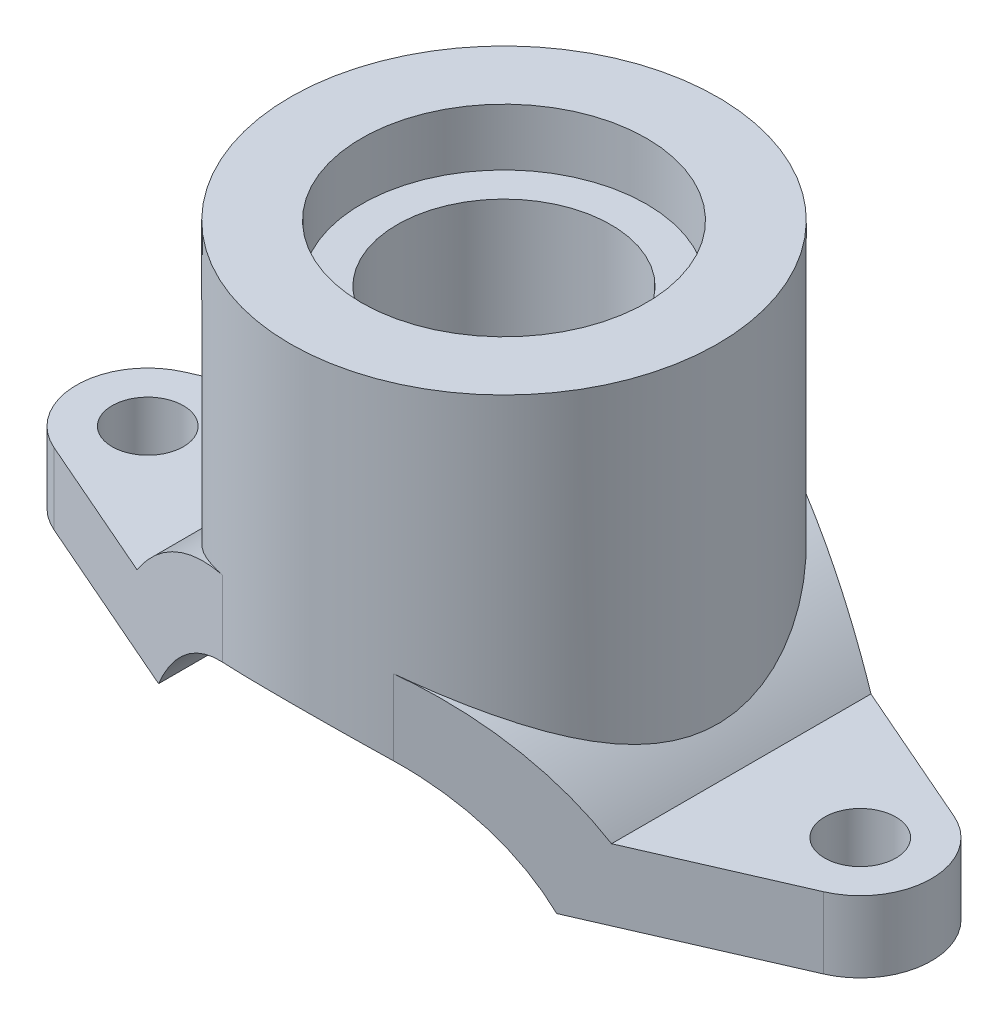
SolidWorks part; units mm, degrees
ref_plane "Front Plane" through (0, 0, 0) normal (0, 0, 1) x (1, 0, 0)
ref_plane "Top Plane" through (0, 0, 0) normal (0, 1, 0) x (1, 0, 0)
ref_plane "Right Plane" through (0, 0, 0) normal (1, 0, 0) x (0, 0, -1)
sketch "Sketch1" plane through (0, 0, 0) normal (0, 0, 1) x (1, 0, 0)
  line L0 (69.8498, 0) -> (150, 0)
  line L1 (-150, 25) -> (-83.2406, 25)
  line L2 (83.2406, 25) -> (150, 25)
  line L3 (-150, 0) -> (-69.8498, 0)
  line L4 (-150, 25) -> (-150, 0)
  line L5 (150, 25) -> (150, 0)
  arc A0 (-69.8498, 0) -> (69.8498, 0) centre (0, -39) cw
  arc A1 (-83.2406, 25) -> (83.2406, 25) centre (0, -39) cw
  dimension "D1" = 80
  dimension "D2" = 39
  dimension "D3" = 300
  dimension "D4" = 25
extrude "Boss-Extrude1" add sketch "Sketch1" along normal mid plane 150
ref_plane "Plane1" through (0, 66, 75) normal (0, 1, 0) x (-1, 0, 0)
sketch "Sketch2" plane through (0, 66, 75) normal (0, 1, 0) x (-1, 0, 0)
  line L0 (-135, -52.0871) -> (-30, -6.2614)
  line L1 (30, -6.2614) -> (135, -52.0871)
  line L2 (-135, -97.9129) -> (-30, -143.7386)
  line L3 (30, -143.7386) -> (135, -97.9129)
  line L4 (83.2406, 0) -> (-83.2406, 0) construction
  arc A0 (-30, -143.7386) -> (30, -143.7386) centre (0, -75) ccw
  arc A1 (135, -97.9129) -> (135, -52.0871) centre (125, -75) ccw
  arc A2 (-135, -52.0871) -> (-135, -97.9129) centre (-125, -75) ccw
  arc A3 (30, -6.2614) -> (-30, -6.2614) centre (0, -75) ccw
  dimension "D2" = 25
  dimension "D3" = 75
  dimension "D1" = 250
extrude "Cut-Extrude1" cut sketch "Sketch2" against normal through all flip side to cut
ref_plane "Plane2" through (0, 150, 0) normal (0, 1, 0) x (-1, 0, 0)
sketch "Sketch3" plane through (0, 150, 0) normal (0, 1, 0) x (-1, 0, 0)
  circle A0 centre (0, 0) radius 75
  dimension "D1" = 150
extrude "Boss-Extrude2" add sketch "Sketch3" against normal up to surface (84 mm away)
sketch "Sketch4" plane through (0, 0, 0) normal (0, 0, 1) x (1, 0, 0)
  line L0 (0, 181.8725) -> (0, 0) construction
  line L1 (0, 0) -> (0, 150)
  line L2 (75, 150) -> (-75, 150) construction
  line L3 (0, 150) -> (50, 150)
  line L4 (50, 150) -> (50, 130)
  line L5 (50, 130) -> (37.5, 130)
  line L6 (37.5, 130) -> (37.5, 0)
  line L7 (37.5, 0) -> (0, 0)
  dimension "D1" = 100
  dimension "D2" = 20
  dimension "D3" = 75
revolve "Cut-Revolve1" cut sketch "Sketch4" angle 360 about L0
sketch "Sketch5" plane through (0, 25, 0) normal (0, 1, 0) x (1, 0, 0)
  circle A0 centre (-125, 0) radius 12.5
  circle A1 centre (125, 0) radius 12.5
  arc A2 (-135, 22.9129) -> (-135, -22.9129) centre (-125, 0) ccw construction
  dimension "D1" = 25
extrude "Cut-Extrude2" cut sketch "Sketch5" against normal through all
